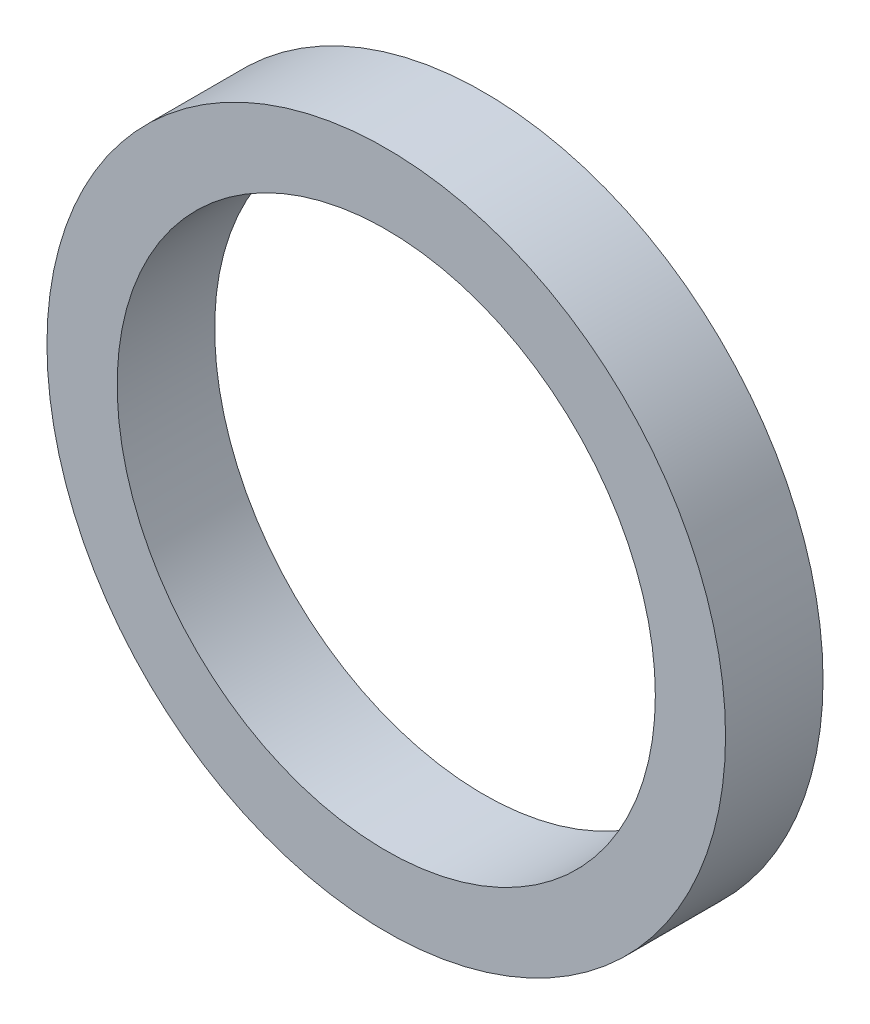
SolidWorks part; units mm, degrees
ref_plane "Plane1" through (0, 0, 0) normal (0, 0, 1) x (1, 0, 0)
ref_plane "Plane2" through (0, 0, 0) normal (0, 1, 0) x (1, 0, 0)
ref_plane "Plane3" through (0, 0, 0) normal (1, 0, 0) x (0, 0, -1)
sketch "Sketch1" plane through (0, 0, 0) normal (0, 0, 1) x (1, 0, 0)
  circle A0 centre (0, 0) radius 11.049
  circle A1 centre (0, 0) radius 8.763
  dimension "D1" = 17.526
  dimension "D2" = 22.098
extrude "Base-Extrude" add sketch "Sketch1" along normal blind 3.175
